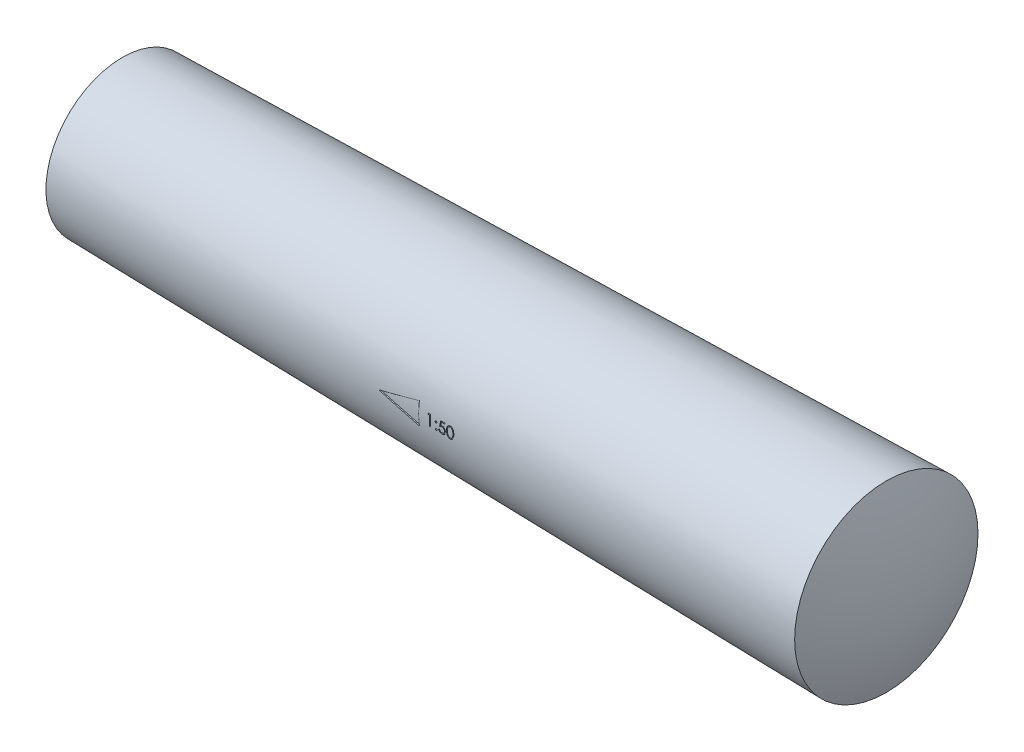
SolidWorks part; units mm, degrees
ref_plane "Front Plane" through (0, 0, 0) normal (0, 0, 1) x (1, 0, 0)
ref_plane "Top Plane" through (0, 0, 0) normal (0, 1, 0) x (1, 0, 0)
ref_plane "Right Plane" through (0, 0, 0) normal (1, 0, 0) x (0, 0, -1)
sketch "Sketch1" plane through (0, 0, 0) normal (1, 0, 0) x (0, 0, -1)
  circle A0 centre (0, 0) radius 7
  dimension "D1" = 14
extrude "Extrude1" add sketch "Sketch1" along normal mid plane 70
draft "Draft1" type of draft neutral plane draft angle 1.146 faces to draft 1 parameters "D1"=1.146
sketch "Sketch2" plane through (0, 0, 0) normal (0, 0, 1) x (1, 0, 0)
  line L0 (-35, 0) -> (-35, 7)
  line L1 (-35, 7) -> (-35, -7) construction
  line L2 (-35, 0) -> (-36.6, 0)
  line L3 (-36.6, 0) -> (-36.6, -7.7) construction
  line L4 (35, 0) -> (35, 8.4)
  line L5 (35, -8.4) -> (35, 8.4) construction
  line L6 (35, 0) -> (36.6, 0)
  line L7 (36.6, 0) -> (36.6, -7.7) construction
  line L8 (-35, -7) -> (35, -8.4) construction
  arc A0 (-36.6, 0) -> (-35, 7) centre (-20.4875, 0) cw
  arc A1 (36.6, 0) -> (35, 8.4) centre (13.7498, 0) ccw
  point P14 (0, -7.7)
revolve "Revolve1" add sketch "Sketch2" angle 360 about L2
sketch "Sketch5" plane through (0, 0, 0) normal (0, 0, 1) x (1, 0, 0)
  line L0 (0, 7.7) -> (0, -7.7) construction
  line L1 (35, 8.4) -> (-35, 7) construction
  line L2 (-35, -7) -> (35, -8.4) construction
ref_plane "Plane2" through (0, 0, 0) normal (-0.02, 0, 0.9998) x (0.9998, 0, 0.02)
sketch "Sketch6" plane through (0, 0, 0) normal (-0.02, 0, 0.9998) x (0.9998, 0, 0.02)
  line L0 (0, 0) -> (0, 1)
  line L1 (0, 7.7) -> (0, -7.7) construction
  line L2 (0, 1) -> (-3.7321, 0)
  line L3 (-3.7321, 0) -> (0, -1)
  line L4 (0, -1) -> (0, 0)
  line L5 (0, -0.5) -> (4, -0.5) construction
  text T0 "1:50" font "Century Gothic" height 1
  dimension "D1" = 2
  dimension "D2" = 30
  dimension "D3" = 4
wrap "Wrap2" sketch "Sketch6" wrap type deboss source sketch "Sketch6" thickness 0.1 parameters "D1"=0.1
equation "\"D2@Sketch2\" = \"D1@Sketch2\""
